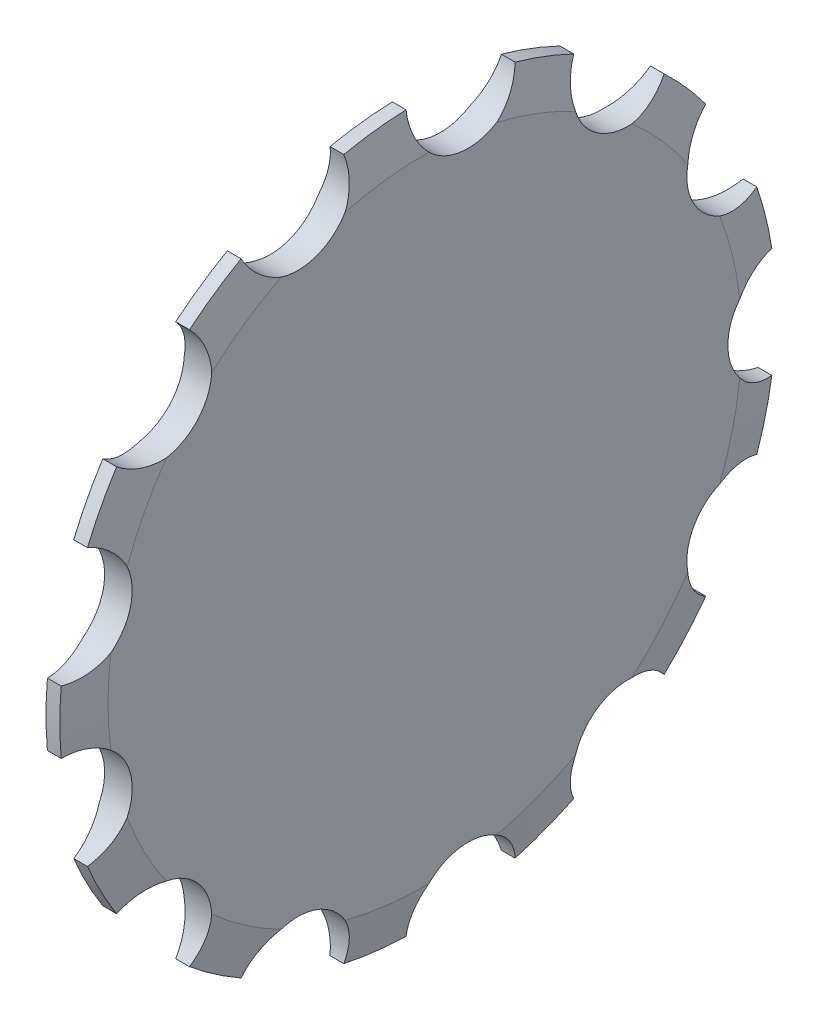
SolidWorks part; units mm, degrees
ref_plane "Plan1" through (0, 0, 0) normal (0, 0, 1) x (1, 0, 0)
ref_plane "Plan2" through (0, 0, 0) normal (0, 1, 0) x (1, 0, 0)
ref_plane "Plan3" through (0, 0, 0) normal (1, 0, 0) x (0, 0, -1)
sketch "Esquisse1" plane through (0, 0, 0) normal (0, 0, 1) x (1, 0, 0)
  line L0 (-40, 0) -> (50, 0) construction
  line L1 (-1, 0) -> (1, 0)
  line L2 (1, 0) -> (1, 23)
  line L4 (-1, 0) -> (-1, 23)
  line L5 (-0.5, 26) -> (0.5, 26)
  line L7 (-1, 23) -> (-0.5, 26)
  line L8 (1, 23) -> (0.5, 26)
  dimension "D1" = 1
  dimension "D2" = 2
  dimension "D3" = 26
revolve "Base-Révolution" add sketch "Esquisse1" angle 360 about L0
sketch "Esquisse2" plane through (1, 0, 0) normal (1, 0, 0) x (0, 0, -1)
  line L0 (-38.5, 0) -> (41, 0) construction
  circle A0 centre (26, 0) radius 4
  circle A1 centre (23.0219, -12.0828) radius 4
  circle A2 centre (14.7697, -21.3976) radius 4
  circle A3 centre (3.134, -25.8104) radius 4
  circle A4 centre (-9.2197, -24.3104) radius 4
  circle A5 centre (-19.4613, -17.2412) radius 4
  circle A6 centre (-25.2445, -6.2222) radius 4
  circle A7 centre (-25.2445, 6.2222) radius 4
  circle A8 centre (-19.4613, 17.2412) radius 4
  circle A9 centre (-9.2197, 24.3104) radius 4
  circle A10 centre (3.134, 25.8104) radius 4
  circle A11 centre (14.7697, 21.3976) radius 4
  circle A12 centre (23.0219, 12.0828) radius 4
  dimension "D1" = 8
  dimension "D2" = 26
extrude "Enlèv. mat.-Extru.1" cut sketch "Esquisse2" against normal through all
